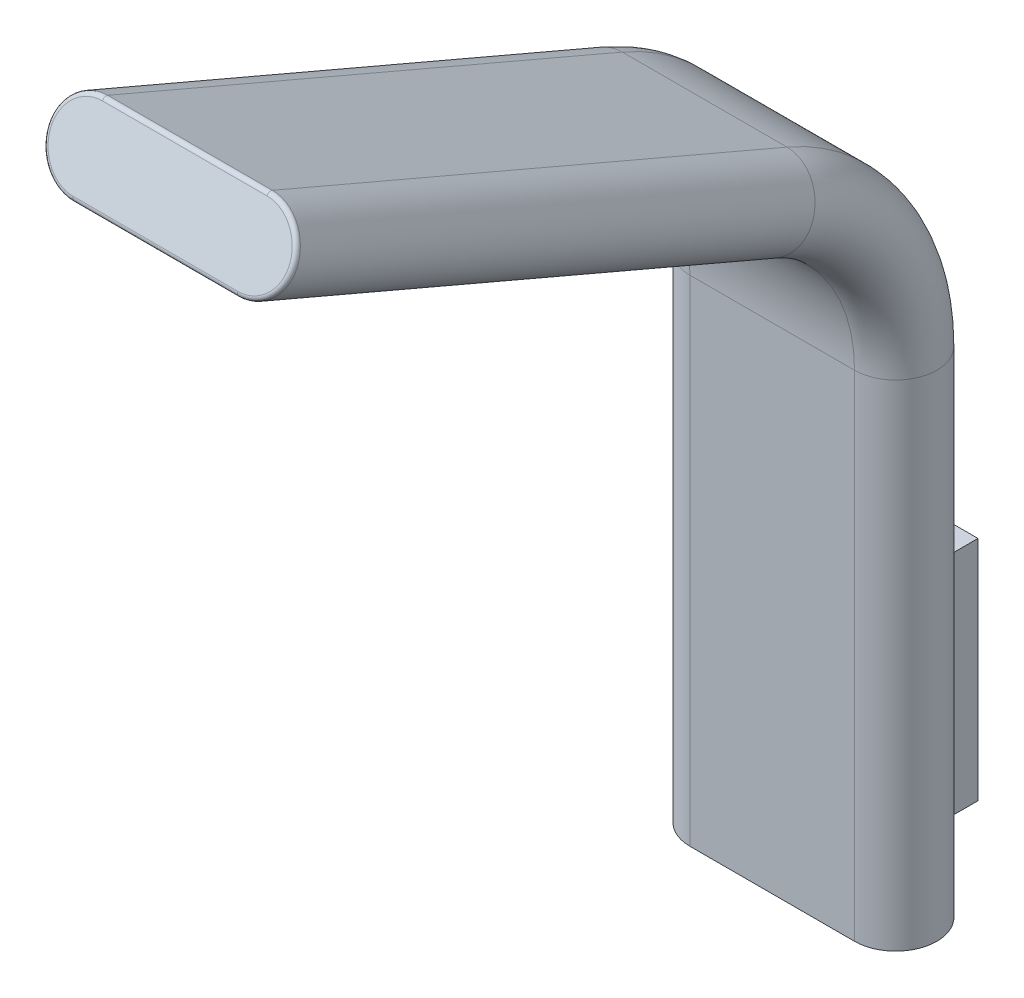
SolidWorks part; units mm, degrees
ref_plane "Alzado" through (0, 0, 0) normal (0, 0, 1) x (1, 0, 0)
ref_plane "Planta" through (0, 0, 0) normal (0, 1, 0) x (1, 0, 0)
ref_plane "Vista lateral" through (0, 0, 0) normal (1, 0, 0) x (0, 0, -1)
sketch "Croquis1" plane through (0, 0, 0) normal (0, 1, 0) x (1, 0, 0)
  line L0 (-30, 0) -> (30, 0) construction
  line L1 (0, 0) -> (0, 10) construction
  line L2 (-20, 10) -> (20, 10)
  line L3 (-20, -10) -> (20, -10)
  arc A1 (-20, 10) -> (-20, -10) centre (-20, 0) ccw
  arc A2 (20, 10) -> (20, -10) centre (20, 0) cw
  point P4 (0, 0)
sketch "Croquis2" plane through (0, 0, 0) normal (1, 0, 0) x (0, 0, -1)
  line L0 (0, 0) -> (0, 120.1933)
  line L1 (-30.3534, 166.1717) -> (-156.3265, 220)
  arc A0 (0, 120.1933) -> (-30.3534, 166.1717) centre (-50, 120.1933) ccw
  point P6 (0, 153.2017)
  dimension "D3" = 50
  dimension "D1" = 220
  dimension "D2" = 170
sweep "Barrer1" add profiles "Croquis1" path "Croquis2"
sketch "Croquis3" plane through (0, 0, -10) normal (0, 0, -1) x (-1, 0, 0)
  line L0 (20, 0) -> (20, 120.1933) construction
  line L1 (-20, 14.5867) -> (20, 14.5867)
  line L2 (-20, 14.5867) -> (-20, 69.7986)
  line L3 (-20, 69.7986) -> (20, 69.7986)
  line L4 (20, 14.5867) -> (20, 69.7986)
  line L5 (-20, 14.5867) -> (20, 69.7986) construction
  line L6 (-20, 69.7986) -> (20, 14.5867) construction
  point P0 (0, 42.1927)
extrude "Saliente-Extruir1" add sketch "Croquis3" along normal blind 10
sketch "Croquis4" plane through (0, 120.3525, -51.4266) normal (0, -0.9196, 0.3929) x (1, 0, 0)
  line L6 (-10, 121.7019) -> (-10, 196.7019)
  line L7 (10, 121.7019) -> (10, 196.7019)
  arc A1 (10, 196.7019) -> (-10, 196.7019) centre (0, 196.7019) ccw
  arc A3 (10, 121.7019) -> (-10, 121.7019) centre (0, 121.7019) cw
extrude "Cortar-Extruir1" cut sketch "Croquis4" against normal blind 1
fillet "Redondeo1" radius 1 4 edges at (0, 229.1957, 152.3972) (30, 220, 156.3265) (0, 210.8043, 160.2559) (-30, 220, 156.3265)
fillet "Redondeo2" radius 1 4 edges at (10, 182.9079, 94.9704) (0, 201.5721, 138.6499) (-10, 182.9079, 94.9704) (0, 164.2436, 51.2909)
